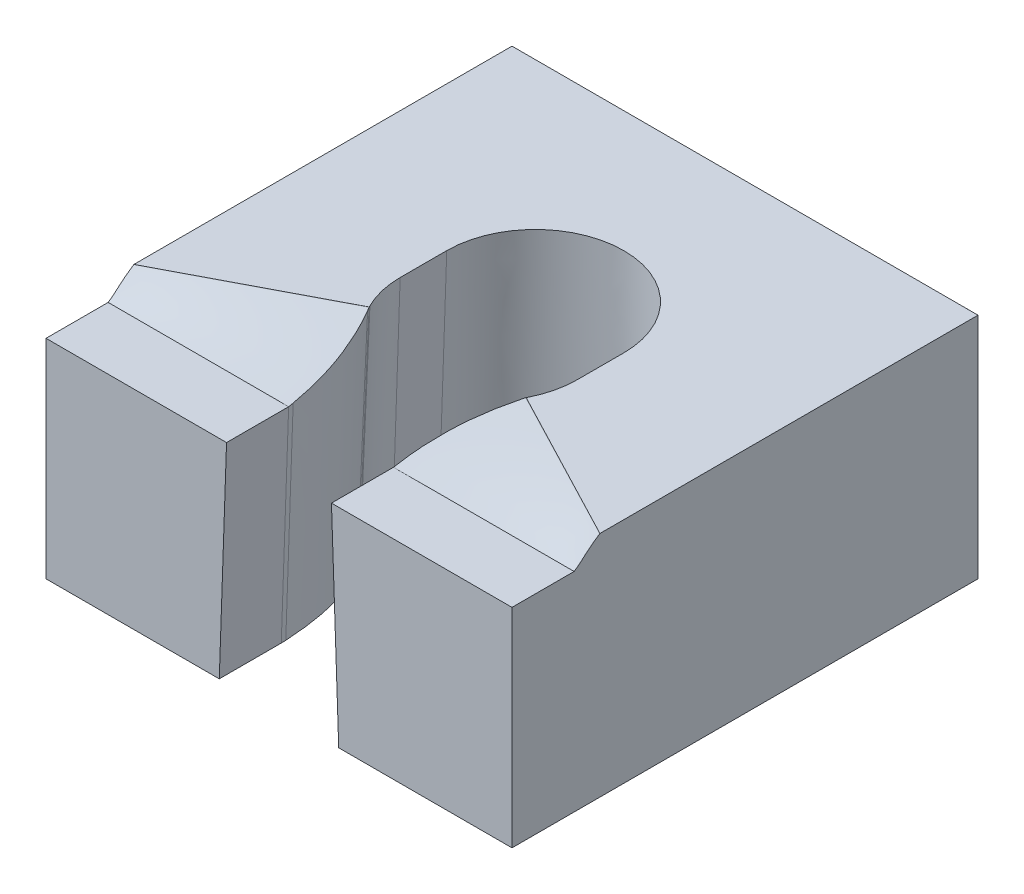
SolidWorks part; units mm, degrees
ref_plane "Vorne" through (0, 0, 0) normal (0, 0, 1) x (1, 0, 0)
ref_plane "Oben" through (0, 0, 0) normal (0, 1, 0) x (1, 0, 0)
ref_plane "Rechts" through (0, 0, 0) normal (1, 0, 0) x (0, 0, -1)
body saved out of another part "Basisteil-Strebe Ø22-1"
other "Fläche verschieben1" parameters "D1"=20
other "Fläche verschieben2" parameters "D1"=20
other "Fläche verschieben3" parameters "D1"=20
other "Fläche verschieben4" parameters "D1"=80
surface "Oberfläche-Offset1" parameters "D1"=0
surface "Oberfläche-Verlängern1" parameters "D1"=1, "D2"=1, "D3"=1, "D4"=1, "D5"=1, "D6"=1, "D7"=1
move or copy body "Körper-Verschieben/Kopieren1" bodies to move or copy 104 copy no translate (0, -1, 0)
other "Oberflächenschnitt1"
delete or keep bodies "Körper-Löschen1" type delete bodies bodies 105
other "Regeloberfläche3" parameters "D1"=60, "D2"=2
surface "Oberfläche-Zusammenfügen1"
other "Oberflächenschnitt2"
